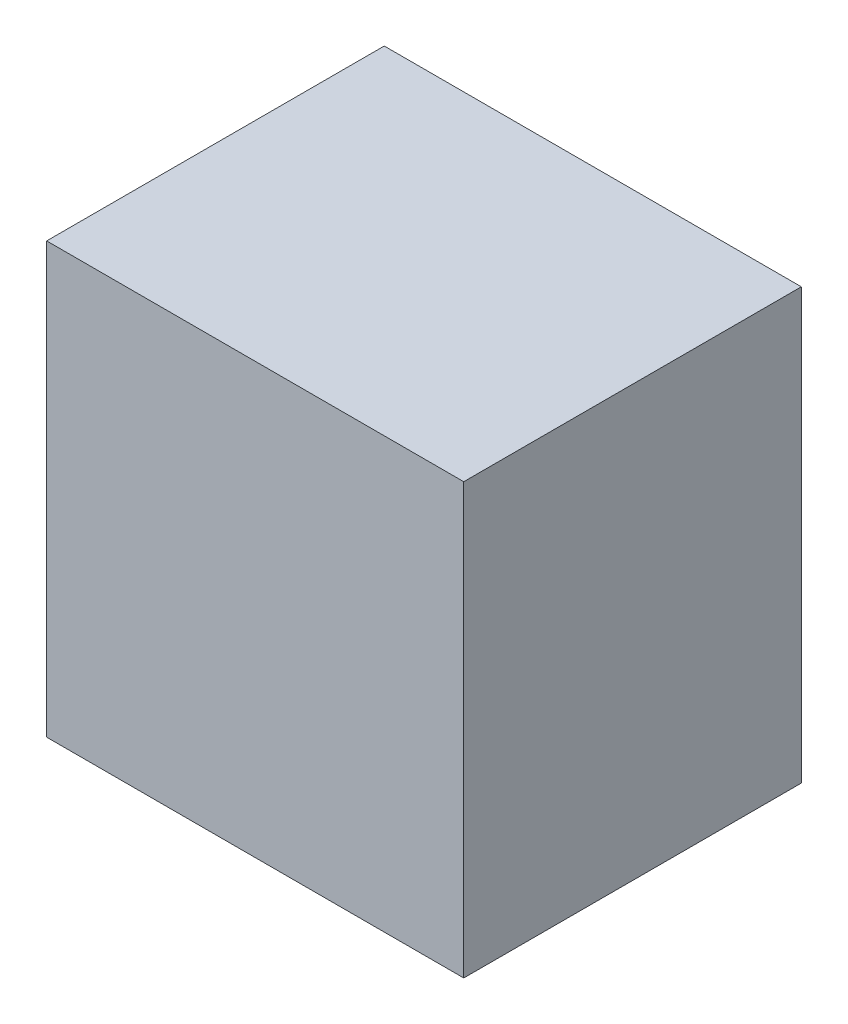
SolidWorks part; units mm, degrees
ref_plane "Front Plane" through (0, 0, 0) normal (0, 0, 1) x (1, 0, 0)
ref_plane "Top Plane" through (0, 0, 0) normal (0, 1, 0) x (1, 0, 0)
ref_plane "Right Plane" through (0, 0, 0) normal (1, 0, 0) x (0, 0, -1)
sketch "Sketch1" plane through (0, 0, 0) normal (0, 0, 1) x (1, 0, 0)
  line L1 (-19.1686, -19.7539) -> (19.1686, -19.7539)
  line L2 (-19.1686, -19.7539) -> (-19.1686, 19.7539)
  line L3 (-19.1686, 19.7539) -> (19.1686, 19.7539)
  line L4 (19.1686, -19.7539) -> (19.1686, 19.7539)
  line L5 (-19.1686, -19.7539) -> (19.1686, 19.7539) construction
  line L6 (-19.1686, 19.7539) -> (19.1686, -19.7539) construction
  point P0 (0, 0)
extrude "Boss-Extrude3" add sketch "Sketch1" along normal blind 31.0298 separate body contours L1 L4 L3 L2
sketch "Sketch5" plane through (0, 0, 31.0298) normal (0, 0, 1) x (1, 0, 0)
  spline S0 degree 3 poles (-115.9323, -23.9796) (-82.2201, 154.7508) (-78.5564, -190.8431) (-31.5107, -4.4323) knots 0 0 0 0 1 1 1 1
ref_plane "Plane8" through (-115.9323, -23.9796, 31.0298) normal (0.1854, 0.9827, 0) x (0.9827, -0.1854, 0)
ref_plane "Plane9" through (0, 0, 0) normal (-1, 0, 0) x (0, 0, 1)
